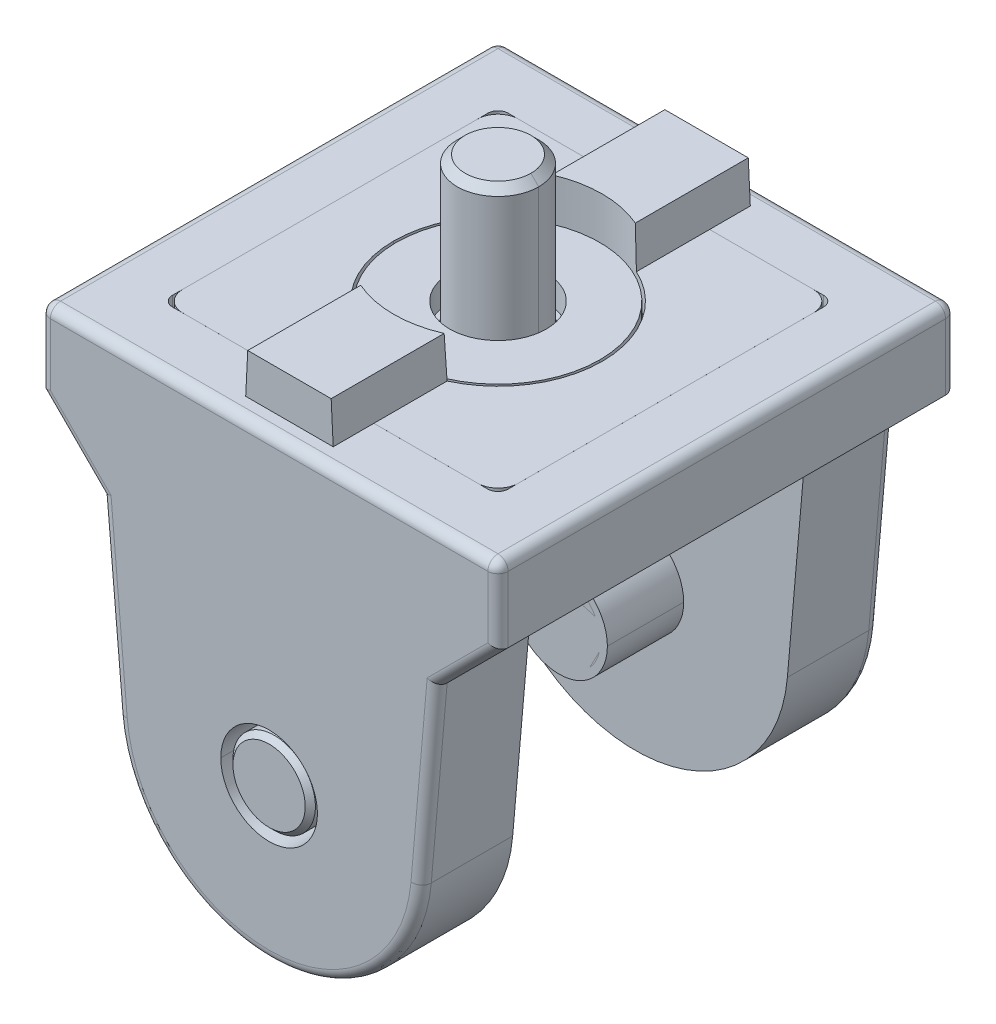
SolidWorks part; units mm, degrees
ref_plane "Front Plane" through (0, 0, 0) normal (0, 0, 1) x (1, 0, 0)
ref_plane "Top Plane" through (0, 0, 0) normal (0, 1, 0) x (1, 0, 0)
ref_plane "Right Plane" through (0, 0, 0) normal (1, 0, 0) x (0, 0, -1)
imported_body "P"
imported_body "Kanta"
imported_body "Kierre"
imported_body "S"
imported_body "Vasen"
imported_body "U"
imported_body "O"
imported_body "K"
imported_body "Oikea"
imported_body "Kierronestolevy"
imported_body "Runko"
fillet "Fillet1" radius 1
sketch "Sketch2" plane through (0, 0, 28.5) normal (0, 0, -1) x (-1, 0, 0)
  circle A0 centre (0, 0) radius 4.05
extrude "Boss-Extrude1" add sketch "Sketch2" against normal blind 16.5
chamfer "Chamfer1" distance 0.5 angle 45 1 edges at (-4.05, 0, 45)
sketch "Sketch3" plane through (0, 0, 16.5) normal (0, 0, 1) x (1, 0, 0)
  circle A0 centre (0, 0) radius 4.05
extrude "Boss-Extrude2" add sketch "Sketch3" against normal blind 16.5 separate body
chamfer "Chamfer2" distance 0.5 angle 45 1 edges at (4.05, 0, 0)
